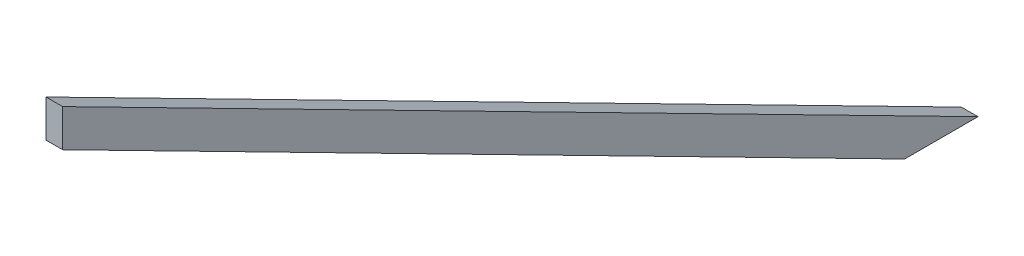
SolidWorks part; units mm, degrees
ref_plane "Face" through (0, 0, 0) normal (0, 0, 1) x (1, 0, 0)
ref_plane "Dessus" through (0, 0, 0) normal (0, 1, 0) x (1, 0, 0)
ref_plane "Droite" through (0, 0, 0) normal (1, 0, 0) x (0, 0, -1)
sketch "Esquisse1" plane through (0, 0, 0) normal (1, 0, 0) x (0, 0, -1)
  line L0 (335.1692, -169.9688) -> (357.1961, -169.9688)
  line L1 (82.2493, -41.0997) -> (335.1692, -169.9688)
  line L3 (82.2493, -29.8764) -> (357.1961, -169.9688)
  line L4 (82.2493, -41.0997) -> (82.2493, -29.8764)
  dimension "D1" = 308.58
  dimension "D2" = 10
  dimension "D3" = 63
extrude "Extrusion1" add sketch "Esquisse1" along normal blind 5
